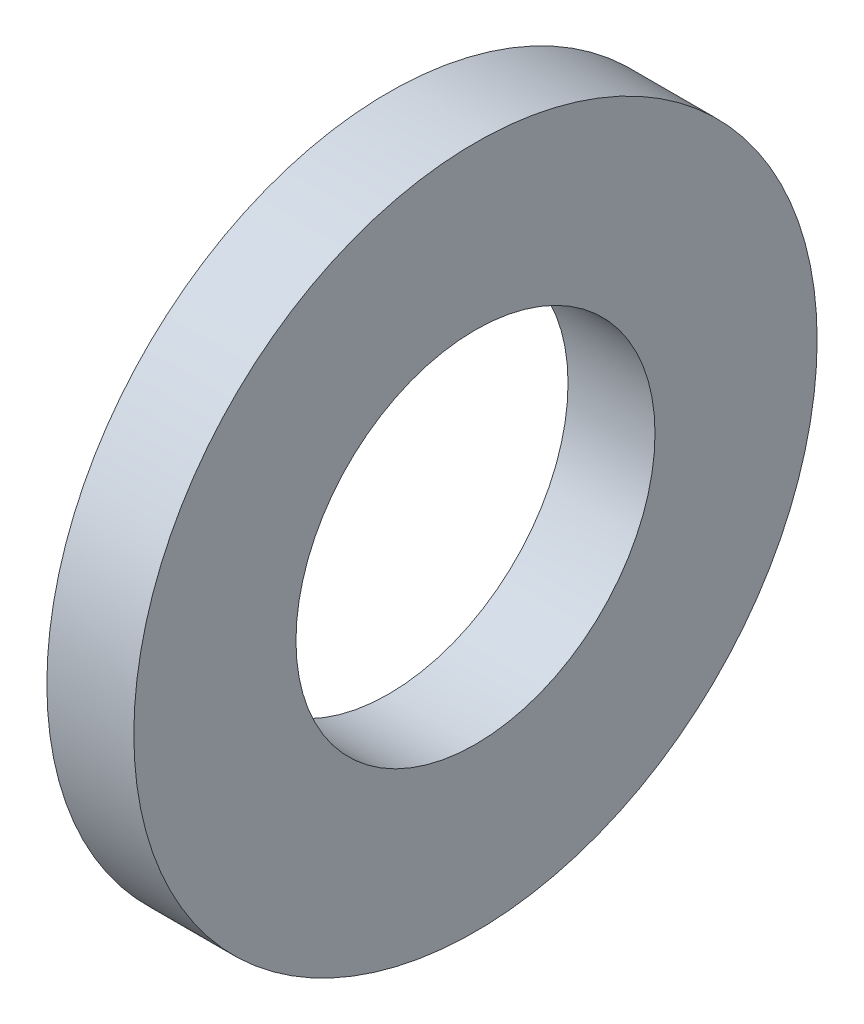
SolidWorks part; units mm, degrees
ref_plane "Plane1" through (0, 0, 0) normal (0, 0, 1) x (1, 0, 0)
ref_plane "Plane2" through (0, 0, 0) normal (0, 1, 0) x (1, 0, 0)
ref_plane "Plane3" through (0, 0, 0) normal (1, 0, 0) x (0, 0, -1)
sketch "Sketch1" plane through (0, 0, 0) normal (0, 0, 1) x (1, 0, 0)
  line L0 (-34.925, 0) -> (9.525, 0) construction
  line L1 (0, 2.89) -> (0, 5.5)
  line L2 (0, 5.5) -> (-1.4, 5.5)
  line L3 (-1.4, 5.5) -> (-1.4, 2.89)
  line L4 (-1.4, 2.89) -> (0, 2.89)
  dimension "Thickness" = 1.4
  dimension "Inside_dia" = 5.78
  dimension "Outside_dia" = 11
revolve "Base-Revolve" add sketch "Sketch1" angle 360 about L0
